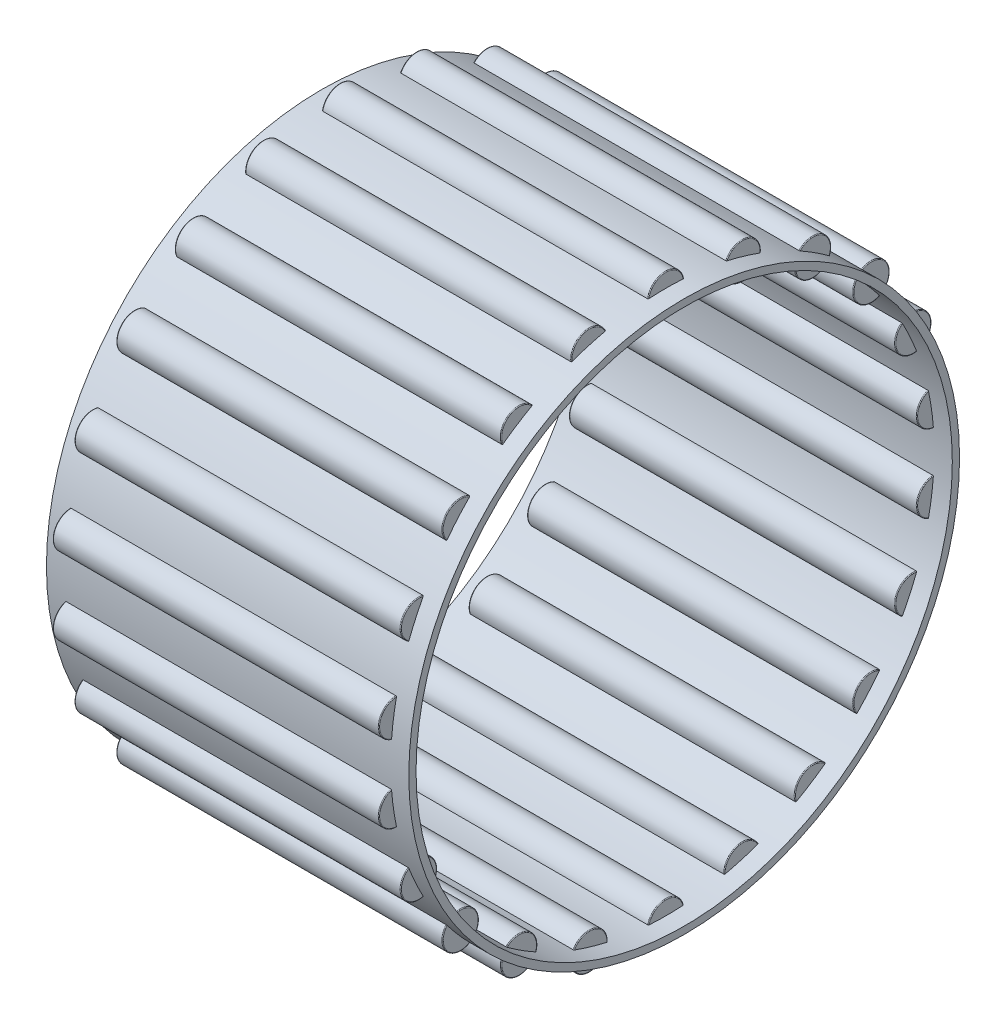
SolidWorks part; units mm, degrees
ref_plane "Plane1" through (0, 0, 0) normal (0, 0, 1) x (1, 0, 0)
ref_plane "Plane2" through (0, 0, 0) normal (0, 1, 0) x (1, 0, 0)
ref_plane "Plane3" through (0, 0, 0) normal (1, 0, 0) x (0, 0, -1)
other "Configuration Table"
sketch "Clipboard" plane through (0, 0, 0) normal (0, 0, 1) x (1, 0, 0)
  line L0 (-10, 0) -> (10, 0) construction
  line L1 (0, 0) -> (20.7325, -8.3765)
  line L2 (0, 0) -> (47.1009, 19.03)
  line L3 (0, 0) -> (23.8125, -9.6209)
  line L4 (0, 0) -> (-44.45, -1.5522)
sketch "CagSpiSke" plane through (0, 0, 0) normal (0, 0, 1) x (1, 0, 0)
  line L0 (15.875, 23.495) -> (15.875, 24.13)
  line L1 (15.875, 24.13) -> (-15.875, 24.13)
  line L2 (-15.875, 24.13) -> (-15.875, 23.495)
  line L3 (-15.875, 23.495) -> (15.875, 23.495)
  line L4 (-12.7, 0) -> (12.7, 0) construction
revolve "CageSpine" add sketch "CagSpiSke" angle 360 about L4
sketch "RolDetSke" plane through (0, 0, 0) normal (0, 0, 1) x (1, 0, 0)
  line L0 (-17.78, 23.8125) -> (17.78, 23.8125) construction
  line L2 (-14.224, 25.4) -> (14.224, 25.4)
  line L3 (-14.2875, 25.3365) -> (-14.2875, 23.8125)
  line L5 (-14.2875, 23.8125) -> (14.2875, 23.8125)
  line L6 (14.2875, 25.3365) -> (14.2875, 23.8125)
  arc A0 (-14.224, 25.4) -> (-14.2875, 25.3365) centre (-14.224, 25.3365) ccw
  arc A1 (14.2875, 25.3365) -> (14.224, 25.4) centre (14.224, 25.3365) ccw
revolve "RollerDetailed" add sketch "RolDetSke" angle 360 about L0
ref_axis "Axis1" through (-50, 0, 0) along (1, 0, 0)
pattern_circular "RollersDetailed" count 22 every 16.364 about axis through (-50, 0, 0) along (1, 0, 0) of "RollerDetailed"
sketch "RolSimSke" plane through (0, 0, 0) normal (0, 0, 1) x (1, 0, 0)
  line L0 (-17.78, 0) -> (17.78, 0) construction
  line L1 (-12.7, 0) -> (-38.1, 0) construction
  line L3 (-14.224, 25.4) -> (14.224, 25.4)
  line L4 (-14.2875, 25.3365) -> (-14.2875, 22.2885)
  line L5 (-14.224, 22.225) -> (14.224, 22.225)
  line L6 (14.2875, 25.3365) -> (14.2875, 22.2885)
  arc A0 (14.2875, 22.2885) -> (14.224, 22.225) centre (14.224, 22.2885) cw
  arc A1 (14.224, 25.4) -> (14.2875, 25.3365) centre (14.224, 25.3365) cw
  arc A2 (-14.2875, 25.3365) -> (-14.224, 25.4) centre (-14.224, 25.3365) cw
  arc A3 (-14.224, 22.225) -> (-14.2875, 22.2885) centre (-14.224, 22.2885) cw
  point P13 (14.2875, 25.4)
  point P16 (-14.2875, 25.4)
  point P19 (-14.2875, 22.225)
revolve "RollersSimplified" [suppressed] add sketch "RolSimSke" angle 360 about L0
equation "\"RollCLRad@Clipboard\" =  ( \"OD@Clipboard\" + \"Bore@Clipboard\" )  / 4"
equation "\"CLRad@RolDetSke\" =  \"RollCLRad@Clipboard\""
equation "\"thickness@CagSpiSke\" =  ( \"OD@Clipboard\" - \"Bore@Clipboard\" )  / 10"
equation "\"cagRadius@CagSpiSke\" =  \"RollCLRad@Clipboard\" -  ( \"thickness@CagSpiSke\" / 2 )"
equation "\"halfWidth@CagSpiSke\" =  \"Width@CagSpiSke\" / 2"
equation "\"Bore@RolSimSke\" =  \"Bore@Clipboard\""
equation "\"Roller_diameter@RolDetSke\" =  ( \"OD@Clipboard\" - \"Bore@Clipboard\" )  / 2"
equation "\"halfCylLen@RolDetSke\" =  \"Cyl_Len@RolDetSke\" / 2"
equation "\"radius@RolDetSke\" =  \"Roller_diameter@RolDetSke\" / 50"
equation "\"Cyl_Len@RolSimSke\" =  \"Cyl_Len@RolDetSke\""
equation "\"D1@RolSimSke\" =  \"Cyl_Len@RolSimSke\"/2"
equation "\"radius@RolSimSke\" =  \"radius@RolDetSke\""
equation "\"Roller_diameter@RolSimSke\" =  ( \"OD@Clipboard\" - \"Bore@Clipboard\" )  / 2"
equation "\"Max_countClipboard_v1\" =  int( 3.14159265 / atn(( \"Roller_diameter@RolDetSke\" / 2) / sqr(\"RollCLRad@Clipboard\"  * \"RollCLRad@Clipboard\" - ( \"Roller_diameter@RolDetSke\" / 2) *  ( \"Roller_diameter@RolD"
equation "\"Max_count@Clipboard\" =  ((sgn( \"Max_countClipboard_v1\" - \"Count@Clipboard\" )-1)*( \"Max_countClipboard_v1\" - \"Count@Clipboard\" ))/-2+ \"Count@Clipboard\""
equation "\"CountRollersDetailed_v1\" =  int( \"Show_count@Clipboard\" )"
equation "\"CountRollersDetailed_v2\" =  ((sgn( \"CountRollersDetailed_v1\" - \"Max_count@Clipboard\" )-1)*( \"CountRollersDetailed_v1\" - \"Max_count@Clipboard\" ))/-2+ \"Max_count@Clipboard\""
equation "\"Count@RollersDetailed\" =  ((sgn( \"CountRollersDetailed_v2\" - \"Min_count@Clipboard\" )+1)*( \"CountRollersDetailed_v2\" - \"Min_count@Clipboard\"))/2 +\"Min_count@Clipboard\""
equation "\"Angle@RollersDetailed\" =  360.0 / \"Max_count@Clipboard\""
